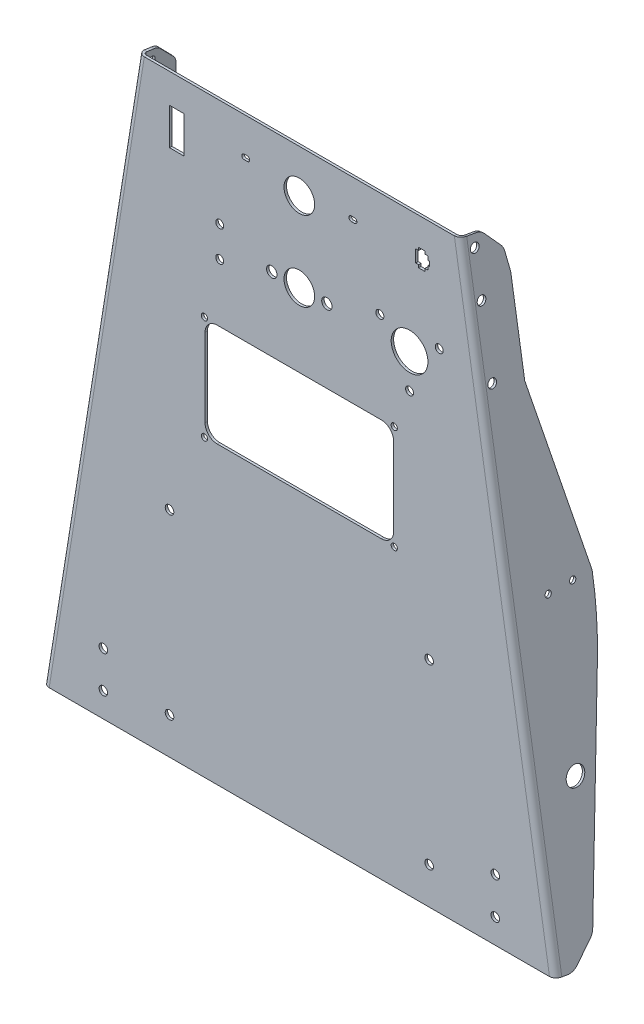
SolidWorks part; units mm, degrees
ref_plane "Plan1" through (0, 0, 0) normal (0, 0, 1) x (1, 0, 0)
ref_plane "Plan2" through (0, 0, 0) normal (0, 1, 0) x (1, 0, 0)
ref_plane "Plan3" through (0, 0, 0) normal (1, 0, 0) x (0, 0, -1)
sketch "Esquisse1" plane through (0, 0, 0) normal (0, 0, 1) x (1, 0, 0)
  line L0 (-233.4033, -367.6071) -> (-223.0023, -381.104)
  line L1 (-215.0814, -385) -> (215.0814, -385)
  line L2 (233.4033, -367.6071) -> (223.0023, -381.104)
  line L3 (140.6804, 100) -> (-139.1804, 100)
  line L4 (-145.1606, 98.0148) -> (-160.1158, 86.8559)
  line L5 (-163.6026, 82.0619) -> (-222.9889, -92.4978)
  line L6 (-238.9112, -195.3054) -> (-235.4802, -361.7093)
  line L7 (163.6026, 82.0619) -> (222.9889, -92.4978)
  line L8 (238.9112, -195.3054) -> (235.4802, -361.7093)
  line L9 (147.064, 97.6973) -> (160.5192, 86.5385)
  line L10 (-45, 72) -> (-42.5, 72)
  line L11 (-106, 76) -> (-94, 76)
  line L12 (-106, 76) -> (-106, 46)
  line L13 (-106, 46) -> (-94, 46)
  line L14 (-94, 76) -> (-94, 46)
  line L15 (-45, 68) -> (-42.5, 68)
  line L16 (45, 72) -> (42.5, 72)
  line L17 (45, 68) -> (42.5, 68)
  line L23 (-235, -385) -> (-220, -385) construction
  circle A0 centre (0, 0) radius 12.5
  arc A3 (147.064, 97.6973) -> (140.6804, 100) centre (140.6804, 90) ccw
  arc A4 (163.6026, 82.0619) -> (160.5192, 86.5385) centre (154.1355, 78.8412) ccw
  arc A5 (-163.6026, 82.0619) -> (-160.1158, 86.8559) centre (-154.1355, 78.8412) cw
  arc A6 (-139.1804, 100) -> (-145.1606, 98.0148) centre (-139.1804, 90) ccw
  circle A7 centre (-65, 12.5) radius 3.25
  circle A8 centre (-65, -12.5) radius 3.25
  arc A9 (-45, 72) -> (-45, 68) centre (-45, 70) ccw
  arc A10 (45, 68) -> (45, 72) centre (45, 70) ccw
  circle A11 centre (-160, -365) radius 3.5
  circle A12 centre (-160, -335) radius 3.5
  arc A13 (-42.5, 68) -> (-42.5, 72) centre (-42.5, 70) ccw
  circle A14 centre (0, 65) radius 12.5
  circle A15 centre (160, -335) radius 3.5
  circle A16 centre (160, -365) radius 3.5
  arc A17 (-238.9112, -195.3054) -> (-222.9889, -92.4978) centre (61.025, -189.1211) cw
  arc A18 (238.9112, -195.3054) -> (222.9889, -92.4978) centre (-61.025, -189.1211) ccw
  arc A19 (223.0023, -381.104) -> (215.0814, -385) centre (215.0814, -375) cw
  arc A20 (233.4033, -367.6071) -> (235.4802, -361.7093) centre (225.4823, -361.5031) ccw
  circle A21 centre (-106, -210) radius 3.5
  circle A22 centre (-106, -355) radius 3.5
  circle A23 centre (106, -355) radius 3.5
  circle A24 centre (106, -210) radius 3.5
  arc A25 (-223.0023, -381.104) -> (-215.0814, -385) centre (-215.0814, -375) ccw
  arc A26 (-233.4033, -367.6071) -> (-235.4802, -361.7093) centre (-225.4823, -361.5031) cw
  arc A27 (42.5, 72) -> (42.5, 68) centre (42.5, 70) ccw
  circle A28 centre (-22.5, 0) radius 4.25
  circle A29 centre (22.5, 0) radius 4.25
  point P0 (-157.5, 100)
  point P44 (-240, -142.5)
  point P45 (240, -142.5)
  point P48 (-162.6031, 85)
  point P53 (-142.5, 100)
  point P54 (-240, -142.5)
  point P57 (240, -142.5)
  point P63 (220, -385)
  point P64 (157.5, 100)
  point P67 (235, -385)
  point P68 (235.4124, -365)
  point P74 (-235.4124, -365)
  dimension "D7" = 25
  dimension "D17" = 15
  dimension "D19" = 6.5
  dimension "D21" = 65
  dimension "D24" = 30
  dimension "D39" = 15
  dimension "D47" = 35
  dimension "D50" = 2.5
  dimension "D25" = 4
  dimension "D30" = 7
  dimension "D33" = 7
  dimension "D13" = 300
  dimension "D41" = 10
  dimension "D42" = 10
  dimension "D45" = 42.5
  dimension "D46" = 25
  dimension "D51" = 2.5
  dimension "D52" = 8.5
  dimension "D53" = 45
  dimension "D54" = 22.5
  dimension "D2" = 470
  dimension "D4" = 100
  dimension "D5" = 15
  dimension "D6" = 235
  dimension "D11" = 240
  dimension "D12" = 240
  dimension "D14" = 315
  dimension "D15" = 157.5
  dimension "D16" = 15
  dimension "D18" = 25
  dimension "D20" = 12.5
  dimension "D22" = 90
  dimension "D23" = 45
  dimension "D26" = 30
  dimension "D27" = 20
  dimension "D28" = 320
  dimension "D29" = 160
  dimension "D31" = 212
  dimension "D32" = 145
  dimension "D34" = 106
  dimension "D35" = 30
  dimension "D36" = 485
  dimension "D37" = 242.5
  dimension "D38" = 20
  dimension "D40" = 20
  dimension "D43" = 94
  dimension "D44" = 85
  dimension "D48" = 12
  dimension "D49" = 30
extrude "Base-Extrusion" add sketch "Esquisse1" along normal mid plane 2
sheet metal parameters "Tôlerie 1" parameters "D1"=3
flatten bends "Dépliage 1" parameters "D1"=0
sketch "Esquisse-Angle1" plane through (0, 0, 1) normal (0, 0, 1) x (1, 0, 0)
process bends "Pliage 1" parameters "D1"=0
sketch "Esquisse-Plate1" plane through (0, 0, 1) normal (0, 0, 1) x (1, 0, 0)
  line L0 (-129.7451, 100) -> (-207.4321, -385) construction
  line L1 (140.6804, 100) -> (-139.1804, 100) construction
  line L2 (-215.0814, -385) -> (215.0814, -385) construction
  line L3 (129.7451, 100) -> (207.4321, -385) construction
  line L4 (-151.0788, 93.2653) -> (-226.0159, -374.5671) construction
  line L5 (226.0159, -374.5671) -> (151.0788, 93.2653) construction
  point P12 (71.5886, -158.0374)
  dimension "D1" = 20
  dimension "D2" = 20
bend "Pli défini à plat1" bend radius 3 bend angle 90 parameters "D5"=1
bend "Pli défini à plat2" bend radius 3 bend angle 90 parameters "D5"=2
sketch "Esquisse2" plane through (143.9517, 23.0581, 0) normal (0.9874, 0.1582, 0) x (0, 0, -1)
  line L0 (34, 82.9908) -> (34, -32.2828)
  line L2 (-1, -412.4589) -> (-1, 78.7236) construction
  line L4 (55.8, 82.9908) -> (34, 82.9908)
  line L5 (34, -32.2828) -> (70.8638, -190.5914)
  line L6 (-1, -190.5914) -> (1, -190.5914) construction
  line L7 (70.8638, -190.5914) -> (92.1365, -190.5914)
  line L8 (92.1365, -190.5914) -> (55.8, 82.9908)
  circle A0 centre (9, 67.7172) radius 3.5
  circle A1 centre (9, 32.7172) radius 3.5
  circle A2 centre (9, -22.2828) radius 3.5
  circle A3 centre (51.0016, -172.2828) radius 2.5
  circle A4 centre (31.0016, -172.2828) radius 2.5
  point P8 (65.4362, -167.2828)
  point P21 (66.0016, -169.7111)
  dimension "D1" = 7
  dimension "D7" = 25
  dimension "D6" = 10
  dimension "D9" = 20
  dimension "D11" = 5
  dimension "D12" = 15
  dimension "D2" = 10
  dimension "D3" = 55
  dimension "D4" = 10
  dimension "D5" = 35
  dimension "D8" = 135
  dimension "D10" = 240
extrude "Enlèv. mat.-Extru.1" cut sketch "Esquisse2" against normal blind 10
sketch "Esquisse3" plane through (-143.9517, 23.0581, 0) normal (-0.9874, 0.1582, 0) x (0, 0, 1)
  line L0 (1, 78.7236) -> (1, -412.4589) construction
  line L1 (-34, 49.1) -> (-34, -32.2828)
  line L2 (-34, -32.2828) -> (-69.0185, -180.9567)
  line L3 (-69.0185, -180.9567) -> (-76.3541, 32.7172)
  line L4 (-76.3541, 32.7172) -> (-34, 49.1)
  circle A0 centre (-9, 67.7172) radius 3.5
  circle A1 centre (-9, 32.7172) radius 3.5
  circle A2 centre (-9, -22.2828) radius 3.5
  circle A3 centre (-42.5539, -132.2828) radius 2.5
  circle A4 centre (-22.5539, -132.2828) radius 2.5
  point P13 (-65.7978, -167.2828)
  point P18 (-57.5539, -132.2828)
  dimension "D5" = 7
  dimension "D9" = 20
  dimension "D10" = 200
  dimension "D11" = 5
  dimension "D12" = 15
  dimension "D1" = 10
  dimension "D2" = 55
  dimension "D3" = 35
  dimension "D4" = 10
  dimension "D6" = 25
  dimension "D7" = 10
  dimension "D8" = 135
extrude "Enlèv. mat.-Extru.2" cut sketch "Esquisse3" against normal blind 10
sketch "Esquisse4" plane through (0, 0, 1) normal (0, 0, 1) x (1, 0, 0)
  line L2 (126.5634, 100) -> (-126.5634, 100) construction
  line L9 (114.2487, 14) -> (90, 0) construction
  line L11 (90, 0) -> (90, -28) construction
  line L39 (65.7513, 14) -> (90, 0) construction
  line L41 (102.6, 75) -> (105, 75)
  line L43 (95, 75) -> (97.4, 75)
  line L138 (95, 75) -> (95, 65)
  line L139 (95, 65) -> (97.4, 65)
  line L140 (105, 75) -> (105, 71.8)
  line L141 (105, 71.8) -> (106.1, 71.8)
  line L142 (102.6, 65) -> (105, 65)
  line L143 (105, 68.2) -> (106.1, 68.2)
  line L144 (106.1, 71.8) -> (106.1, 68.2)
  line L145 (105, 68.2) -> (105, 65)
  line L146 (97.4, 75) -> (97.4, 77.25)
  line L147 (97.4, 77.25) -> (102.6, 77.25)
  line L148 (102.6, 75) -> (102.6, 77.25)
  line L150 (97.4, 65) -> (97.4, 62.75)
  line L151 (97.4, 62.75) -> (102.6, 62.75)
  line L152 (102.6, 65) -> (102.6, 62.75)
  line L153 (-67, -60) -> (67, -60)
  line L154 (-77, -70) -> (-77, -134)
  line L155 (-67, -144) -> (67, -144)
  line L156 (77, -70) -> (77, -134)
  arc A0 (-77, -70) -> (-67, -60) centre (-67, -70) cw
  arc A1 (-67, -144) -> (-77, -134) centre (-67, -134) cw
  arc A2 (77, -134) -> (67, -144) centre (67, -134) cw
  arc A3 (77, -70) -> (67, -60) centre (67, -70) ccw
  circle A4 centre (-77.5, -59.5) radius 2.55
  circle A5 centre (77.5, -59.5) radius 2.55
  circle A6 centre (-77.5, -144.5) radius 2.55
  circle A7 centre (77.5, -144.5) radius 2.55
  circle A17 centre (65.7513, 14) radius 3.25
  circle A18 centre (114.2487, 14) radius 3.25
  circle A19 centre (90, -28) radius 3.25
  circle A20 centre (90, 0) radius 15
  point P8 (-77, -144)
  point P12 (77, -144)
  point P17 (77, -60)
  dimension "D58" = 6.5
  dimension "D108" = 30
  dimension "D36" = 154
  dimension "D4" = 10
  dimension "D7" = 5.1
  dimension "D8" = 155
  dimension "D6" = 90
  dimension "D2" = 77
  dimension "D9" = 77.5
  dimension "D13" = 85
  dimension "D14" = 0.5
  dimension "D15" = 100
  dimension "D37" = 84
  dimension "D55" = 28
  dimension "D56" = 120
  dimension "D57" = 120
  dimension "D109" = 25
  dimension "D110" = 10
  dimension "D111" = 10
  dimension "D112" = 3.6
  dimension "D113" = 3.2
  dimension "D114" = 11.1
  dimension "D115" = 14.5
  dimension "D116" = 5.2
  dimension "D117" = 2.4
  dimension "D118" = 2.25
  dimension "D119" = 95
  dimension "D121" = 60
extrude "Enlèv. mat.-Extru.8" cut sketch "Esquisse4" against normal blind 10
sketch "Esquisse5" plane through (143.9517, 23.0581, 0) normal (0.9874, 0.1582, 0) x (0, 0, -1)
  line L0 (-1, -412.4589) -> (-1, 78.7236) construction
  circle A0 centre (34, -294.172) radius 7.5
  dimension "D3" = 15
  dimension "D1" = 35
  dimension "D2" = 120
extrude "Enlèv. mat.-Extru.9" cut sketch "Esquisse5" against normal blind 10
